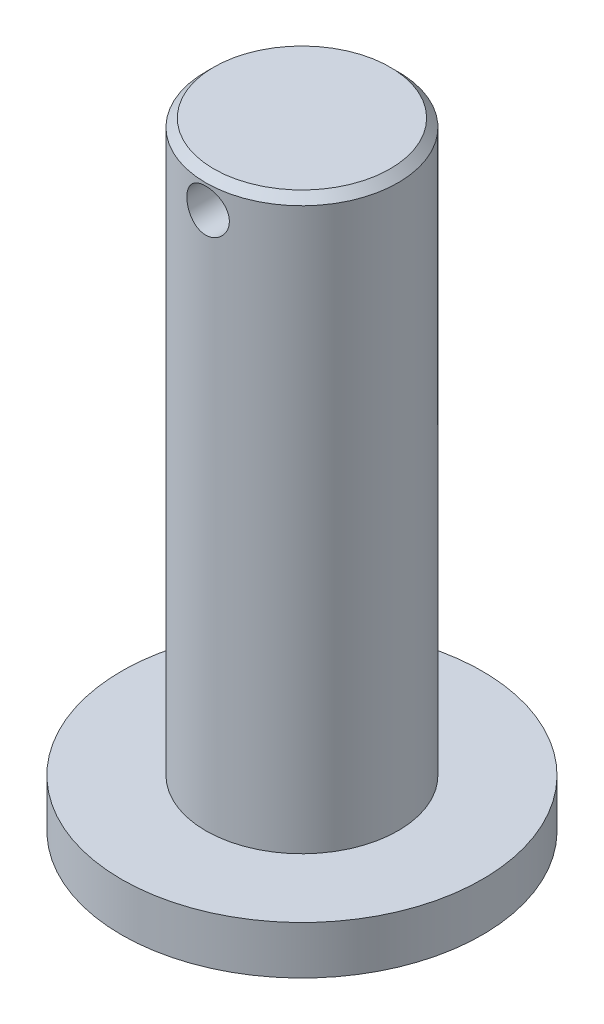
SolidWorks part; units mm, degrees
ref_plane "Plan de face" through (0, 0, 0) normal (0, 0, 1) x (1, 0, 0)
ref_plane "Plan de dessus" through (0, 0, 0) normal (0, 1, 0) x (1, 0, 0)
ref_plane "Plan de droite" through (0, 0, 0) normal (1, 0, 0) x (0, 0, -1)
sketch "Esquisse1" plane through (0, 0, 0) normal (0, 1, 0) x (1, 0, 0)
  circle A0 centre (0, 0) radius 22.5
  dimension "D1" = 45
extrude "Extrusion1" add sketch "Esquisse1" along normal blind 6
sketch "Esquisse2" plane through (0, 6, 0) normal (0, 1, 0) x (1, 0, 0)
  circle A0 centre (0, 0) radius 12
  dimension "D1" = 24
extrude "Extrusion2" add sketch "Esquisse2" along normal blind 71
chamfer "Chanfrein1" distance 1 angle 45 1 edges at (0, 77, 12)
sketch "Esquisse3" plane through (0, 0, 0) normal (0, 0, 1) x (1, 0, 0)
  line L0 (11, 77) -> (-11, 77) construction
  circle A0 centre (0, 73) radius 2.65
  dimension "D1" = 5.3
  dimension "D2" = 4
extrude "Extrusion3" cut sketch "Esquisse3" against normal mid plane 71
